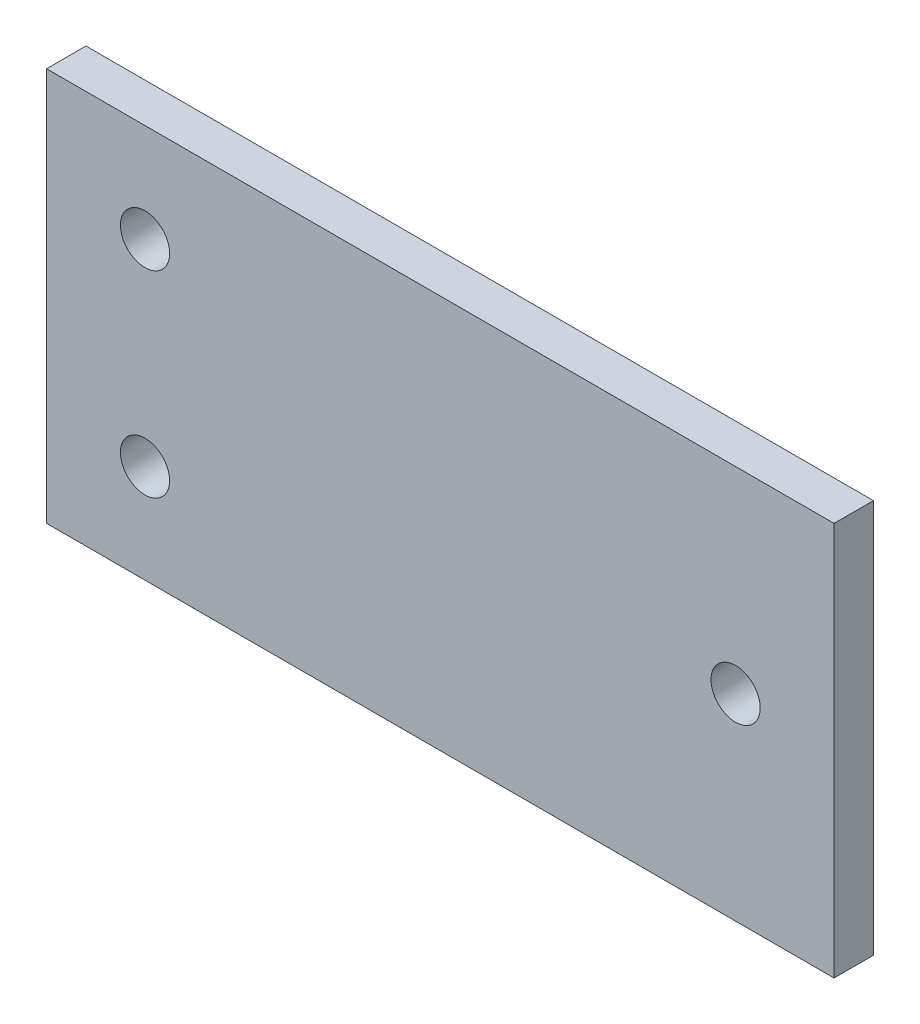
SolidWorks part; units mm, degrees
ref_plane "Piano frontale" through (0, 0, 0) normal (0, 0, 1) x (1, 0, 0)
ref_plane "Piano superiore" through (0, 0, 0) normal (0, 1, 0) x (1, 0, 0)
ref_plane "Piano destro" through (0, 0, 0) normal (1, 0, 0) x (0, 0, -1)
sketch "Schizzo1" plane through (0, 0, 0) normal (0, 0, 1) x (1, 0, 0)
  line L1 (0, 0) -> (160, 0)
  line L2 (0, 0) -> (0, 80)
  line L3 (0, 80) -> (160, 80)
  line L4 (160, 0) -> (160, 80)
  circle A0 centre (20, 60) radius 5
  circle A1 centre (20, 20) radius 5
  dimension "D4" = 10
  dimension "D5" = 10
  dimension "D1" = 80
  dimension "D2" = 160
  dimension "D3" = 20
  dimension "D6" = 20
  dimension "D7" = 20
extrude "Estrusione-Estrusione1" add sketch "Schizzo1" along normal blind 8
hole_wizard "Foro Ø10.0 (10)-1" positions "Schizzo2" profile "Schizzo3" hole size "Ø10.0" standard "ISO"
sketch "Schizzo2" plane through (0, 0, 0) normal (0, 0, -1) x (-1, 0, 0)
  line L0 (-160, 80) -> (0, 80) construction
  line L1 (-160, 0) -> (-160, 80) construction
  point P0 (-140, 40)
  point P8 (-124.3642, 89.6767)
  dimension "D1" = 40
  dimension "D2" = 20
sketch "Schizzo3" plane through (140, 40, 0) normal (1, 0, 0) x (0, 1, 0)
  line L0 (0, 0) -> (0, 8)
  line L1 (0, 8) -> (5, 8)
  line L2 (5, 8) -> (5, 0)
  line L5 (5, 0) -> (0, 0)
  line L11 (0, -6.35) -> (0, 107.95) construction
  dimension "Thru Hole Dia." = 10
  dimension "Thru Hole Depth" = 8
